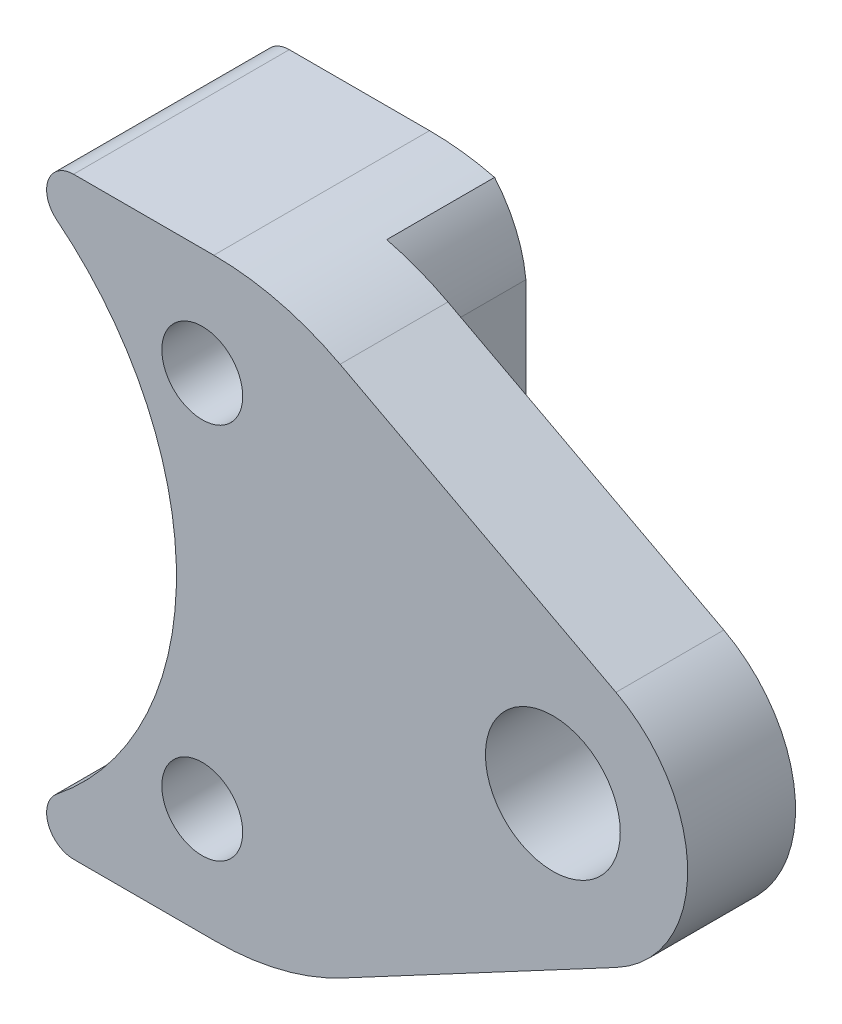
SolidWorks part; units mm, degrees
ref_plane "Plan de face" through (0, 0, 0) normal (0, 0, 1) x (1, 0, 0)
ref_plane "Plan de dessus" through (0, 0, 0) normal (0, 1, 0) x (1, 0, 0)
ref_plane "Plan de droite" through (0, 0, 0) normal (1, 0, 0) x (0, 0, -1)
sketch "Esquisse1" plane through (0, 0, 0) normal (0, 0, 1) x (1, 0, 0)
  line L0 (20, -11) -> (12.2279, -11)
  line L1 (19.9133, 11) -> (32.3401, 4.4186)
  line L2 (19.9133, 11) -> (12.2279, 11)
  line L3 (0, 0) -> (22.9627, 0) construction
  line L4 (20, -11) -> (32.3529, -4.4118)
  circle A0 centre (17, 7) radius 1.5
  arc A1 (12.2279, 11) -> (11.6043, 9.2183) centre (12.2279, 10) ccw
  arc A2 (32.3401, 4.4186) -> (32.3529, -4.4118) centre (30, 0) cw
  arc A4 (12.2279, -11) -> (11.6043, -9.2183) centre (12.2279, -10) cw
  circle A5 centre (17, -7) radius 1.5
  circle A6 centre (30, 0) radius 2.5
  arc A7 (11.6043, 9.2183) -> (11.6043, -9.2183) centre (4.25, 0) cw
  dimension "D1" = 3
  dimension "D2" = 1
  dimension "D4" = 30
  dimension "D6" = 5
  dimension "D5" = 5
  dimension "D3" = 17
extrude "Extrusion1" add sketch "Esquisse1" along normal blind 8
fillet "Congé1" radius 10 2 edges at (19.9133, 11, 4) (20, -11, 4)
sketch "Esquisse2" plane through (0, 0, 0) normal (0, 0, -1) x (-1, 0, 0)
  line L0 (-32.3401, 4.4186) -> (-22.1089, 9.8371)
  line L2 (-22.2059, -9.8235) -> (-32.3529, -4.4118)
  line L3 (-21, -8) -> (-21, 8)
  arc A0 (-32.3401, 4.4186) -> (-32.3529, -4.4118) centre (-30, 0) ccw
  arc A1 (-19.84, 10.7049) -> (-21, 8) centre (-16.098, 7.4989) ccw
  arc A2 (-17.4287, 11) -> (-22.1089, 9.8371) centre (-17.4287, 1) ccw construction
  arc A3 (-21, -8) -> (-19.2915, -10.8382) centre (-17.5241, -7.841) ccw
  arc A4 (-22.2059, -9.8235) -> (-17.5, -11) centre (-17.5, -1) ccw construction
  arc A5 (-22.1089, 9.8371) -> (-19.84, 10.7049) centre (-17.4287, 1) cw
  arc A6 (-22.2059, -9.8235) -> (-19.2915, -10.8382) centre (-17.5, -1) ccw
extrude "Enlèv. mat.-Extru.1" cut sketch "Esquisse2" against normal blind 4
